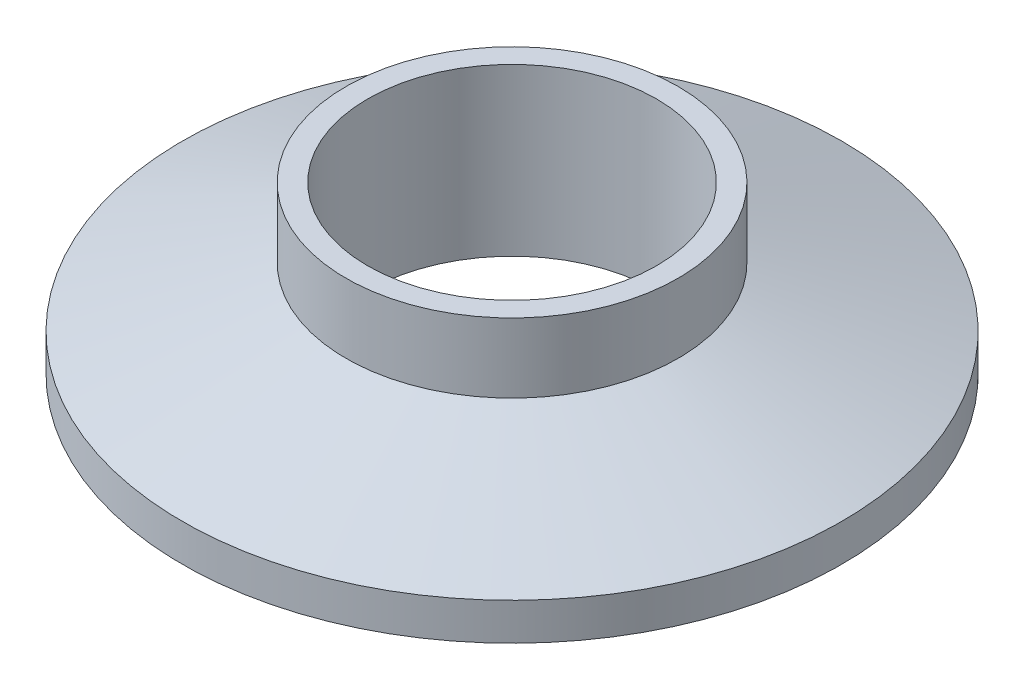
SolidWorks part; units mm, degrees
ref_plane "Front Plane" through (0, 0, 0) normal (0, 0, 1) x (1, 0, 0)
ref_plane "Top Plane" through (0, 0, 0) normal (0, 1, 0) x (1, 0, 0)
ref_plane "Right Plane" through (0, 0, 0) normal (1, 0, 0) x (0, 0, -1)
sketch "Sketch1" plane through (0, 0, 0) normal (0, 0, 1) x (1, 0, 0)
  line L0 (0, 0) -> (0, 12.7) construction
  line L1 (0, 12.7) -> (-12.7, 12.7)
  line L2 (-12.7, 12.7) -> (-12.7, 7.3933)
  line L3 (-12.7, 7.3933) -> (-25.1968, 2.8448)
  line L4 (-25.1968, 2.8448) -> (-25.1968, 0)
  line L5 (-25.1968, 0) -> (-23.6366, 0)
  line L6 (-20.0006, 0) -> (0, 0)
  line L7 (0, 0) -> (0, 12.7)
  line L8 (0, 12.7) -> (-11.049, 12.7)
  line L9 (-11.049, 12.7) -> (-11.049, 0)
  line L10 (-11.049, 0) -> (0, 0)
  line L11 (0, 0) -> (-0.1846, 0.0129)
  arc A0 (-22.9141, 0.4745) -> (-20.7231, 0.4745) centre (-21.8186, 0) cw
  arc A1 (-20.0006, 0) -> (-20.7231, 0.4745) centre (-20.0006, 0.7874) cw
  arc A2 (-22.9141, 0.4745) -> (-23.6366, 0) centre (-23.6366, 0.7874) cw
  point P12 (-20.6248, 0)
  dimension "D1" = 12.7
  dimension "D3" = 25.1968
  dimension "D8" = 1.651
  dimension "D9" = 12.7
revolve "Revolve2" add sketch "Sketch1" angle 360 about L0
